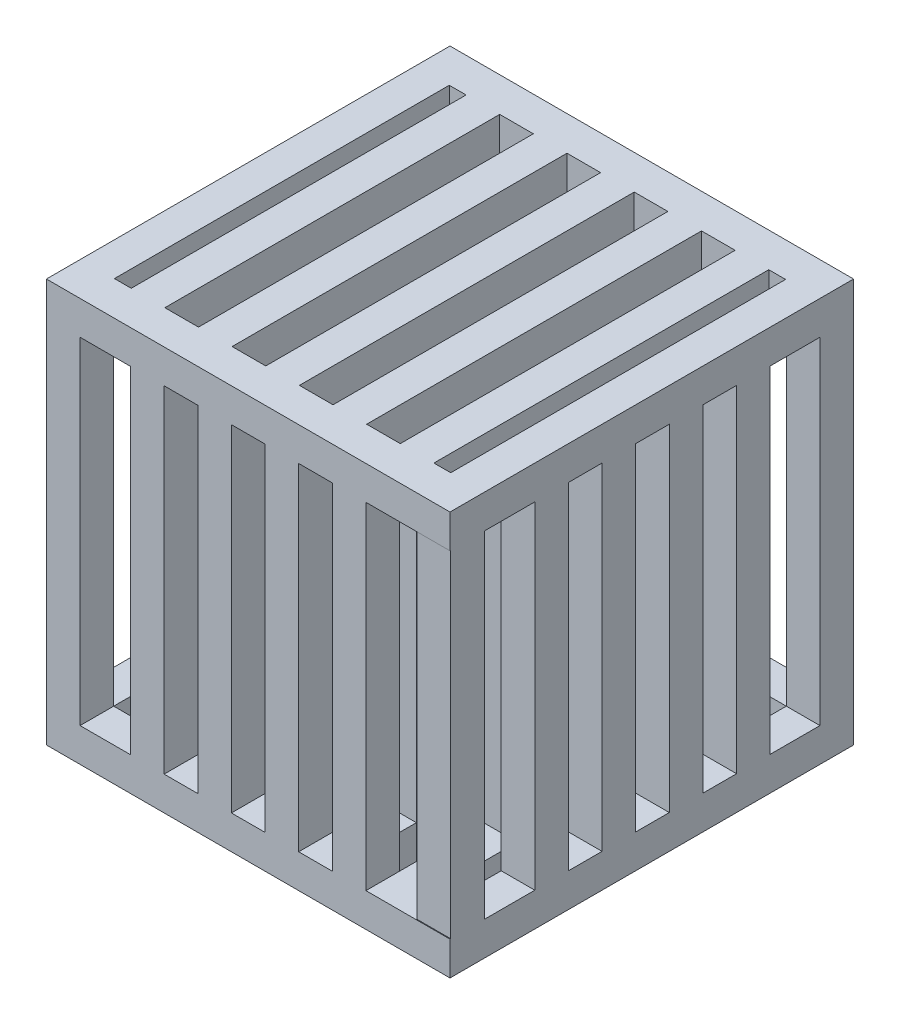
SolidWorks part; units mm, degrees
ref_plane "Piano frontale" through (0, 0, 0) normal (0, 0, 1) x (1, 0, 0)
ref_plane "Piano superiore" through (0, 0, 0) normal (0, 1, 0) x (1, 0, 0)
ref_plane "Piano destro" through (0, 0, 0) normal (1, 0, 0) x (0, 0, -1)
sketch "Sketch1" plane through (0, 0, 0) normal (0, 1, 0) x (1, 0, 0)
  line L0 (-30, -30) -> (-30, 30)
  line L1 (-25, -25) -> (25, -25)
  line L2 (-25, -25) -> (-25, 25)
  line L3 (-25, 25) -> (25, 25)
  line L4 (25, -25) -> (25, 25)
  line L5 (-25, -25) -> (25, 25) construction
  line L6 (-25, 25) -> (25, -25) construction
  line L7 (-30, 30) -> (30, 30)
  line L8 (30, -30) -> (30, 30)
  line L9 (-30, -30) -> (30, -30)
  point P0 (0, 0)
  dimension "D1" = 50
  dimension "D2" = 50
  dimension "D3" = 5
extrude "Boss-Extrude1" add sketch "Sketch1" along normal blind 5
sketch "Sketch2" plane through (0, 0, 25) normal (0, 0, -1) x (-1, 0, 0)
  line L0 (25, 0) -> (-25, 0) construction
  line L1 (22.5, 5) -> (17.5, 5)
  line L2 (22.5, 5) -> (22.5, 0)
  line L3 (22.5, 0) -> (17.5, 0)
  line L4 (17.5, 5) -> (17.5, 0)
  line L5 (22.5, 5) -> (17.5, 0) construction
  line L6 (22.5, 0) -> (17.5, 5) construction
  line L7 (25, 5) -> (25, 0) construction
  point P0 (20, 2.5)
  dimension "D1" = 5
  dimension "D2" = 2.5
  dimension "D3" = 5
extrude "Boss-Extrude2" add sketch "Sketch2" along normal blind 50
pattern_linear "LPattern2" count 5 spacing 10 along (1, 0, 0) of "Boss-Extrude2"
sketch "Sketch3" plane through (0, 5, 0) normal (0, 1, 0) x (1, 0, 0)
  line L0 (-17.5, 25) -> (-17.5, -25) construction
  line L1 (-22.5, -22.5) -> (-17.5, -22.5)
  line L2 (-22.5, -22.5) -> (-22.5, -17.5)
  line L3 (-22.5, -17.5) -> (-17.5, -17.5)
  line L4 (-17.5, -22.5) -> (-17.5, -17.5)
  line L5 (-22.5, -22.5) -> (-17.5, -17.5) construction
  line L6 (-22.5, -17.5) -> (-17.5, -22.5) construction
  point P0 (-20, -20)
  dimension "D1" = 5
  dimension "D2" = 5
  dimension "D3" = 2.5
extrude "Boss-Extrude3" add sketch "Sketch3" along normal blind 50
pattern_linear "LPattern4" count 5 spacing 10 along (0, 0, -1) of "Boss-Extrude3"
sketch "Sketch4" plane through (0, 5, 0) normal (0, 1, 0) x (1, 0, 0)
  line L0 (-12.5, 25) -> (-12.5, -25) construction
  line L1 (-7.5, -17.5) -> (-12.5, -17.5)
  line L2 (-7.5, -17.5) -> (-7.5, -12.5)
  line L3 (-7.5, -12.5) -> (-12.5, -12.5)
  line L4 (-12.5, -17.5) -> (-12.5, -12.5)
  line L5 (-7.5, -17.5) -> (-12.5, -12.5) construction
  line L6 (-7.5, -12.5) -> (-12.5, -17.5) construction
  line L7 (-7.5, -25) -> (-2.5, -25) construction
  point P0 (-10, -15)
  dimension "D1" = 5
  dimension "D2" = 5
  dimension "D3" = 7.5
extrude "Boss-Extrude4" add sketch "Sketch4" along normal blind 50
pattern_linear "LPattern5" count 4 spacing 10 along (0, 0, -1) of "Boss-Extrude4"
sketch "Sketch5" plane through (0, 5, 0) normal (0, 1, 0) x (1, 0, 0)
  line L0 (-2.5, 25) -> (-2.5, -25) construction
  line L1 (2.5, -22.5) -> (-2.5, -22.5)
  line L2 (2.5, -22.5) -> (2.5, -17.5)
  line L3 (2.5, -17.5) -> (-2.5, -17.5)
  line L4 (-2.5, -22.5) -> (-2.5, -17.5)
  line L5 (2.5, -22.5) -> (-2.5, -17.5) construction
  line L6 (2.5, -17.5) -> (-2.5, -22.5) construction
  point P0 (0, -20)
  dimension "D1" = 5
  dimension "D2" = 2.5
  dimension "D3" = 5
sketch "Sketch6" plane through (0, 5, 0) normal (0, 1, 0) x (1, 0, 0)
  line L0 (22.5, -22.5) -> (17.5, -22.5)
  line L1 (22.5, -22.5) -> (22.5, -17.6628)
  line L2 (22.5, -17.6628) -> (17.5, -17.6628)
  line L3 (17.5, -22.5) -> (17.5, -17.6628)
  line L4 (22.5, -22.5) -> (17.5, -17.6628) construction
  line L5 (22.5, -17.6628) -> (17.5, -22.5) construction
  line L6 (17.5, 25) -> (17.5, -25) construction
  point P0 (20, -20.0814)
  dimension "D1" = 2.5
  dimension "D2" = 0
  dimension "D3" = 5
sketch "Sketch7" plane through (0, 5, 0) normal (0, 1, 0) x (1, 0, 0)
  line L0 (12.5, -17.5) -> (7.5, -17.5)
  line L1 (12.5, -17.5) -> (12.5, -12.5076)
  line L2 (12.5, -12.5076) -> (7.5, -12.5076)
  line L3 (7.5, -17.5) -> (7.5, -12.5076)
  line L4 (12.5, -17.5) -> (7.5, -12.5076) construction
  line L5 (12.5, -12.5076) -> (7.5, -17.5) construction
  line L6 (7.5, 25) -> (7.5, -25) construction
  point P0 (10, -15.0038)
  point P5 (0, 0)
  dimension "D1" = 7.5
  dimension "D2" = 0
  dimension "D3" = 5
extrude "Boss-Extrude5" add sketch "Sketch5" along normal blind 50 contours L3 L4 L1 L2
pattern_linear "LPattern6" count 5 spacing 10 along (0, 0, -1) of "Boss-Extrude5"
extrude "Boss-Extrude6" add sketch "Sketch7" along normal blind 50
pattern_linear "LPattern7" count 4 spacing 10 along (0, 0, -1) of "Boss-Extrude6"
extrude "Boss-Extrude7" add sketch "Sketch6" along normal blind 50 contours L2 L3 L0 L1
pattern_linear "LPattern8" count 5 spacing 10 along (0, 0, -1) of "Boss-Extrude7"
sketch "Sketch9" plane through (0, 5, 0) normal (0, 1, 0) x (1, 0, 0)
  line L0 (25, -29.8922) -> (30, -29.8922)
  line L1 (-30, -30) -> (-25, -30)
  line L2 (-30, -30) -> (-30, -25)
  line L3 (-30, -25) -> (-25, -25)
  line L4 (-25, -30) -> (-25, -25)
  line L5 (-30, -30) -> (-25, -25) construction
  line L6 (-30, -25) -> (-25, -30) construction
  line L7 (25, -29.8922) -> (25, -24.8922)
  line L8 (25, -24.8922) -> (30, -24.8922)
  line L9 (30, -29.8922) -> (30, -24.8922)
  line L10 (25, -29.8922) -> (30, -24.8922) construction
  line L11 (25, -24.8922) -> (30, -29.8922) construction
  line L12 (30, -30) -> (30, 30) construction
  line L13 (25, 25) -> (30, 25)
  line L14 (25, 25) -> (25, 30)
  line L15 (25, 30) -> (30, 30)
  line L16 (30, 25) -> (30, 30)
  line L17 (25, 25) -> (30, 30) construction
  line L18 (25, 30) -> (30, 25) construction
  line L19 (30, 30) -> (-30, 30) construction
  line L20 (-30, 25) -> (-25, 25)
  line L21 (-30, 25) -> (-30, 30)
  line L22 (-30, 30) -> (-25, 30)
  line L23 (-25, 25) -> (-25, 30)
  line L24 (-30, 25) -> (-25, 30) construction
  line L25 (-30, 30) -> (-25, 25) construction
  line L26 (-30, 30) -> (-30, -30) construction
  point P0 (-27.5, -27.5)
  point P6 (27.5, -27.3922)
  point P13 (27.5, 27.5)
  point P20 (-27.5, 27.5)
  dimension "D1" = 5
  dimension "D2" = 5
  dimension "D3" = 5
  dimension "D4" = 0
  dimension "D5" = 5
  dimension "D6" = 0
  dimension "D7" = 0
  dimension "D8" = 5
  dimension "D9" = 5
  dimension "D10" = 0
  dimension "D11" = 0
extrude "Boss-Extrude8" add sketch "Sketch9" along normal blind 50
sketch "Sketch10" plane through (0, 55, 0) normal (0, 1, 0) x (1, 0, 0)
  line L1 (30, 30) -> (-30, 30)
  line L2 (30, 30) -> (30, -30)
  line L3 (30, -30) -> (-30, -30)
  line L4 (-30, 30) -> (-30, -30)
  line L5 (30, 30) -> (-30, -30) construction
  line L6 (30, -30) -> (-30, 30) construction
  line L7 (-25, 24.8922) -> (25, 24.8922)
  line L8 (-25, 24.8922) -> (-25, -24.8922)
  line L9 (-25, -24.8922) -> (25, -24.8922)
  line L10 (25, 24.8922) -> (25, -24.8922)
  line L11 (-25, 24.8922) -> (25, -24.8922) construction
  line L12 (-25, -24.8922) -> (25, 24.8922) construction
  point P0 (0, 0)
  point P5 (0, 0)
extrude "Boss-Extrude9" add sketch "Sketch10" along normal blind 5
sketch "Sketch11" plane through (0, 0, -24.8922) normal (0, 0, 1) x (1, 0, 0)
  line L0 (25, 55) -> (-25, 55) construction
  line L1 (17.5, 60) -> (22.5, 60)
  line L2 (17.5, 60) -> (17.5, 55)
  line L3 (17.5, 55) -> (22.5, 55)
  line L4 (22.5, 60) -> (22.5, 55)
  line L5 (17.5, 60) -> (22.5, 55) construction
  line L6 (17.5, 55) -> (22.5, 60) construction
  point P0 (20, 57.5)
  dimension "D1" = 5
  dimension "D2" = 5
  dimension "D3" = 2.5
extrude "Boss-Extrude11" add sketch "Sketch11" along normal blind 50 separate body
pattern_linear "LPattern9" count 5 spacing 10 along (-1, 0, 0) of "Boss-Extrude11"
sketch "Sketch12" plane through (0, 5, 0) normal (0, 1, 0) x (1, 0, 0)
  line L0 (25, -24.8922) -> (25, 25) construction
  line L1 (30, -17.3922) -> (25, -17.3922)
  line L2 (30, -17.3922) -> (30, -12.3922)
  line L3 (30, -12.3922) -> (25, -12.3922)
  line L4 (25, -17.3922) -> (25, -12.3922)
  line L5 (30, -17.3922) -> (25, -12.3922) construction
  line L6 (30, -12.3922) -> (25, -17.3922) construction
  point P0 (27.5, -14.8922)
  dimension "D1" = 5
  dimension "D2" = 5
  dimension "D3" = 7.5
extrude "Boss-Extrude12" add sketch "Sketch12" along normal blind 50
pattern_linear "LPattern10" count 4 spacing 10 along (0, 0, -1) of "Boss-Extrude12"
sketch "Sketch13" plane through (0, 5, 0) normal (0, 1, 0) x (1, 0, 0)
  line L0 (17.5, 25) -> (12.5, 25)
  line L1 (17.5, 25) -> (17.5, 30)
  line L2 (12.5, 25) -> (12.5, 30)
  line L3 (17.5, 30) -> (12.5, 30)
  dimension "D1" = 5
extrude "Boss-Extrude13" add sketch "Sketch13" along normal blind 50 contours L2 L3 L1 L0
pattern_linear "LPattern11" count 4 spacing 10 along (-1, 0, 0) of "Boss-Extrude13"
sketch "Sketch14" plane through (0, 5, 0) normal (0, 1, 0) x (1, 0, 0)
  line L0 (-25, 17.5) -> (-25, 12.676)
  line L1 (-25, 17.5) -> (-30, 17.5)
  line L2 (-25, 12.676) -> (-30, 12.676)
  line L3 (-30, 17.5) -> (-30, 12.676)
  line L4 (-25, 25) -> (-25, -25) construction
  line L6 (-30, 25) -> (-25, 25) construction
  dimension "D1" = 5
  dimension "D2" = 7.5
extrude "Boss-Extrude14" add sketch "Sketch14" along normal blind 50
pattern_linear "LPattern12" count 4 spacing 10 along (0, 0, 1) of "Boss-Extrude14"
sketch "Sketch15" plane through (0, 5, 0) normal (0, 1, 0) x (1, 0, 0)
  line L0 (-17.5, -25) -> (-12.5, -25)
  line L1 (-17.5, -25) -> (-17.5, -30)
  line L2 (-12.5, -25) -> (-12.5, -30)
  line L3 (-17.5, -30) -> (-12.5, -30)
  dimension "D1" = 5
extrude "Boss-Extrude15" add sketch "Sketch15" along normal blind 50
pattern_linear "LPattern13" count 4 spacing 10 along (1, 0, 0) of "Boss-Extrude15"
